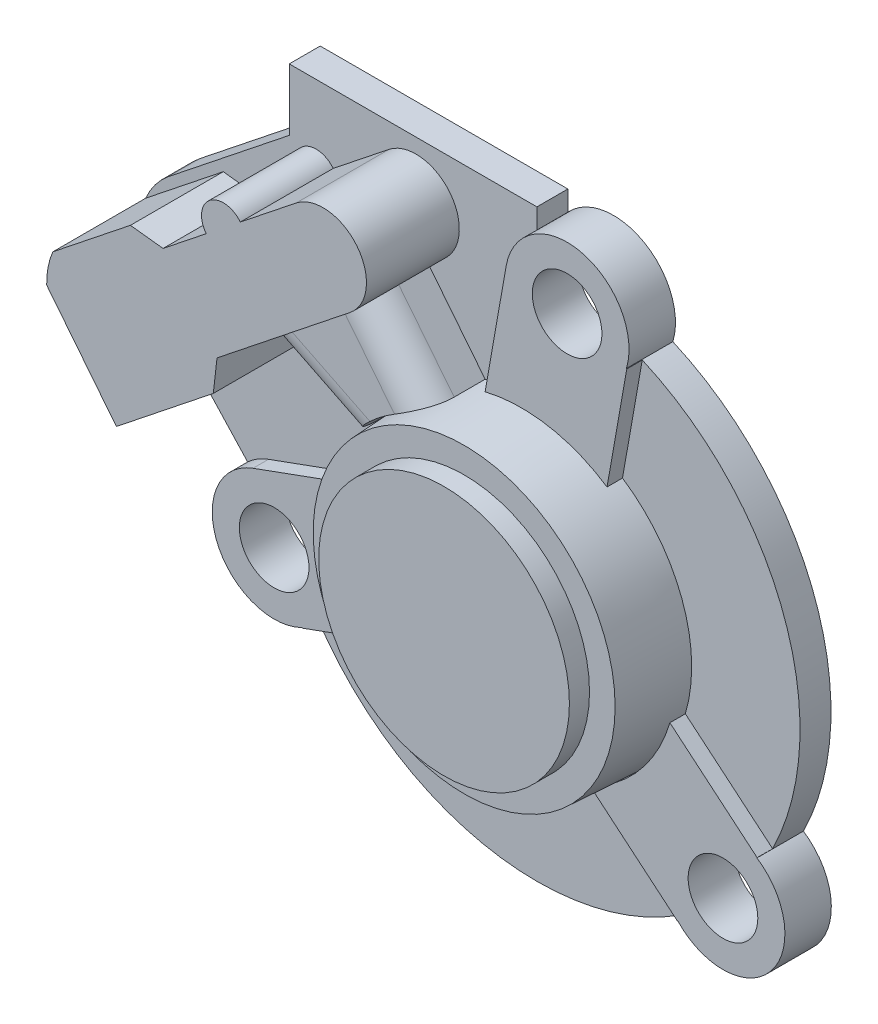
SolidWorks part; units mm, degrees
ref_plane "正面" through (0, 0, 0) normal (0, 0, 1) x (1, 0, 0)
ref_plane "平面" through (0, 0, 0) normal (0, 1, 0) x (1, 0, 0)
ref_plane "右側面" through (0, 0, 0) normal (1, 0, 0) x (0, 0, -1)
sketch "ｽｹｯﾁ1" plane through (0, 0, 0) normal (0, 0, 1) x (1, 0, 0)
  line L5 (41.4554, 47.8391) -> (47.1099, 41.7228)
  line L6 (65.8, 64.0409) -> (65.8, 65.3417)
  line L7 (65.8, 65.3417) -> (49.8, 65.3417)
  line L8 (49.8, 65.3417) -> (49.8, 61.3417)
  line L9 (49.8, 61.3417) -> (42.0135, 55.1458)
  line L10 (41.4554, 47.8391) -> (47.1099, 41.7228)
  line L11 (65.8, 64.0409) -> (65.8, 65.3417)
  line L12 (65.8, 65.3417) -> (49.8, 65.3417)
  line L13 (49.8, 65.3417) -> (49.8, 61.3417)
  line L14 (49.8, 61.3417) -> (42.0135, 55.1458)
  arc A6 (47.1099, 41.7228) -> (51.626, 35.2139) centre (49.8252, 38.7857) ccw
  arc A7 (51.626, 35.2139) -> (75.909, 30.9322) centre (65.8, 44.6) ccw
  arc A8 (75.909, 30.9322) -> (81.0156, 37.018) centre (78.8228, 33.6726) ccw
  arc A9 (81.0156, 37.018) -> (72.5822, 60.1885) centre (65.8, 44.6) ccw
  arc A10 (72.5822, 60.1885) -> (65.8, 64.0409) centre (68.752, 61.3417) ccw
  arc A11 (42.0135, 55.1458) -> (41.4554, 47.8391) centre (45.1268, 51.2333) ccw
  arc A12 (47.1099, 41.7228) -> (51.626, 35.2139) centre (49.8252, 38.7857) ccw
  arc A13 (51.626, 35.2139) -> (75.909, 30.9322) centre (65.8, 44.6) ccw
  arc A14 (75.909, 30.9322) -> (81.0156, 37.018) centre (78.8228, 33.6726) ccw
  arc A15 (81.0156, 37.018) -> (72.5822, 60.1885) centre (65.8, 44.6) ccw
  arc A16 (72.5822, 60.1885) -> (65.8, 64.0409) centre (68.752, 61.3417) ccw
  arc A17 (42.0135, 55.1458) -> (41.4554, 47.8391) centre (45.1268, 51.2333) ccw
  dimension "D1" = 0
extrude "ﾎﾞｽ - 押し出し1" add sketch "ｽｹｯﾁ1" along normal blind 2
sketch "ｽｹｯﾁ2" plane through (0, 0, 2) normal (0, 0, 1) x (1, 0, 0)
  circle A0 centre (65.8, 44.6) radius 10
  dimension "D1" = 20
extrude "ﾎﾞｽ - 押し出し2" add sketch "ｽｹｯﾁ2" along normal blind 4.7 draft 3
sketch "ｽｹｯﾁ3" plane through (0, 0, 6.7) normal (0, 0, 1) x (1, 0, 0)
  circle A0 centre (65.8, 44.6) radius 8.1
  dimension "D1" = 16.2
extrude "ﾎﾞｽ - 押し出し3" add sketch "ｽｹｯﾁ3" along normal blind 1.3 contours A0
sketch "ｽｹｯﾁ5" plane through (0, 0, 2) normal (0, 0, 1) x (1, 0, 0)
  line L0 (65.8, 44.6) -> (78.8228, 33.6726) construction
  line L1 (63.2288, 41.5358) -> (76.2516, 30.6084)
  line L2 (68.3712, 47.6642) -> (81.3939, 36.7368)
  line L3 (64.4319, 48.3588) -> (48.4571, 42.5444)
  line L4 (67.1681, 40.8412) -> (51.1933, 35.0269)
  line L5 (41.4554, 47.8391) -> (47.1099, 41.7228)
  line L6 (65.8, 64.0409) -> (65.8, 65.3417)
  line L7 (65.8, 65.3417) -> (49.8, 65.3417)
  line L8 (49.8, 65.3417) -> (49.8, 61.3417)
  line L9 (49.8, 61.3417) -> (42.0135, 55.1458)
  line L10 (41.4554, 47.8391) -> (47.1099, 41.7228)
  line L11 (65.8, 64.0409) -> (65.8, 65.3417)
  line L12 (65.8, 65.3417) -> (49.8, 65.3417)
  line L13 (49.8, 65.3417) -> (49.8, 61.3417)
  line L14 (49.8, 61.3417) -> (42.0135, 55.1458)
  line L15 (65.8, 44.6) -> (49.8252, 38.7857) construction
  line L16 (69.7392, 43.9054) -> (72.6913, 60.6471)
  line L17 (61.8608, 45.2946) -> (64.8128, 62.0363)
  line L18 (65.8, 44.6) -> (68.752, 61.3417) construction
  arc A0 (48.9089, 42.6793) -> (51.626, 35.2139) centre (49.8252, 38.7857) ccw
  arc A1 (72.5822, 60.1885) -> (64.7584, 61.5681) centre (68.752, 61.3417) ccw
  arc A6 (42.0135, 55.1458) -> (41.4554, 47.8391) centre (45.1268, 51.2333) ccw
  arc A7 (47.1099, 41.7228) -> (51.626, 35.2139) centre (49.8252, 38.7857) ccw
  arc A8 (51.626, 35.2139) -> (75.909, 30.9322) centre (65.8, 44.6) ccw
  arc A9 (75.909, 30.9322) -> (81.0156, 37.018) centre (78.8228, 33.6726) ccw
  arc A10 (81.0156, 37.018) -> (72.5822, 60.1885) centre (65.8, 44.6) ccw
  arc A11 (72.5822, 60.1885) -> (65.8, 64.0409) centre (68.752, 61.3417) ccw
  arc A12 (42.0135, 55.1458) -> (41.4554, 47.8391) centre (45.1268, 51.2333) ccw
  arc A13 (47.1099, 41.7228) -> (51.626, 35.2139) centre (49.8252, 38.7857) ccw
  arc A14 (51.626, 35.2139) -> (75.909, 30.9322) centre (65.8, 44.6) ccw
  arc A15 (75.909, 30.9322) -> (81.0156, 37.018) centre (78.8228, 33.6726) ccw
  arc A16 (81.0156, 37.018) -> (72.5822, 60.1885) centre (65.8, 44.6) ccw
  arc A17 (72.5822, 60.1885) -> (65.8, 64.0409) centre (68.752, 61.3417) ccw
  dimension "D1" = 0
  dimension "D2" = 4
  dimension "D3" = 4
  dimension "D4" = 3
extrude "ﾎﾞｽ - 押し出し4" add sketch "ｽｹｯﾁ5" along normal blind 1
sketch "ｽｹｯﾁ6" plane through (0, 0, 2) normal (0, 0, 1) x (1, 0, 0)
  line L0 (57.987, 61.5886) -> (41.9553, 48.8317)
  line L1 (49.8, 61.3417) -> (42.0135, 55.1458) construction
  line L2 (56.2435, 63.7796) -> (40.2119, 51.0227)
  line L3 (59.7304, 59.3976) -> (43.6988, 46.6407)
  line L4 (43.6988, 46.6407) -> (40.2119, 51.0227)
  line L5 (51.1325, 52.556) -> (50.8927, 50.4483)
  line L6 (50.8927, 50.4483) -> (44.6328, 45.467)
  line L7 (44.6328, 45.467) -> (43.6988, 46.6407)
  line L8 (40.2119, 51.0227) -> (39.2779, 52.1965)
  line L9 (39.2779, 52.1965) -> (45.5379, 57.1777)
  line L10 (45.5379, 57.1777) -> (47.6456, 56.938)
  line L11 (51.1325, 52.556) -> (47.6456, 56.938) construction
  circle A0 centre (57.987, 61.5886) radius 2.8
  circle A1 centre (51.5373, 60.0347) radius 1.4071
  dimension "D3" = 1.5
  dimension "D4" = 1.5
  dimension "D5" = 8
  dimension "D6" = 45
  dimension "D7" = 45
  dimension "D1" = 2.8
  dimension "D2" = 2.8
extrude "ﾎﾞｽ - 押し出し5" add sketch "ｽｹｯﾁ6" along normal blind 6
sketch "ｽｹｯﾁ8" plane through (0, 0, 2) normal (0, 0, 1) x (1, 0, 0)
  line L0 (57.6442, 50.3865) -> (51.949, 53.2057)
  line L1 (59.9326, 52.6978) -> (56.5899, 56.8986)
  line L2 (59.7304, 59.3976) -> (51.1325, 52.556) construction
  line L3 (59.7304, 59.3976) -> (51.1325, 52.556)
  line L4 (59.7304, 59.3976) -> (51.1325, 52.556) construction
  line L5 (62.4555, 54.0241) -> (58.7809, 58.6421)
  line L6 (62.1236, 54.4412) -> (58.7809, 58.6421) construction
  arc A0 (63.4523, 54.3205) -> (55.8195, 45.2241) centre (65.8, 44.6) ccw construction
  arc A1 (63.4523, 54.3205) -> (55.8195, 45.2241) centre (65.8, 44.6) ccw
  dimension "D1" = 2.8
extrude "ﾎﾞｽ - 押し出し6" add sketch "ｽｹｯﾁ8" along normal blind 4 contours L5 L3 L1 M6 | L1 L0 M6 M20
fillet "ﾌｨﾚｯﾄ1" radius 2 2 edges at (54.7966, 51.7961, 6) (60.6182, 56.3331, 6)
hole_wizard "M4 すきま穴1" positions "ｽｹｯﾁ9" profile "ｽｹｯﾁ10" hole size "M4" standard "JIS"
sketch "ｽｹｯﾁ9" plane through (0, 0, 3) normal (0, 0, 1) x (1, 0, 0)
  point P0 (68.752, 61.3417)
  point P3 (49.8252, 38.7857)
  point P6 (78.8228, 33.6726)
sketch "ｽｹｯﾁ10" plane through (68.752, 61.3417, 3) normal (1, 0, 0) x (0, -1, 0)
  line L0 (0, 0) -> (0, 12.8519)
  line L1 (0, 12.8519) -> (2.25, 11.5)
  line L2 (2.25, 11.5) -> (2.25, 0)
  line L5 (2.25, 0) -> (0, 0)
  line L10 (0, 12.8519) -> (-2.25, 11.5) construction
  line L11 (0, -6.35) -> (0, 107.95) construction
  dimension "穴の直径" = 4.5
  dimension "穴の深さ" = 11.5
  dimension "ﾄﾞﾘﾙ角度" = 118
